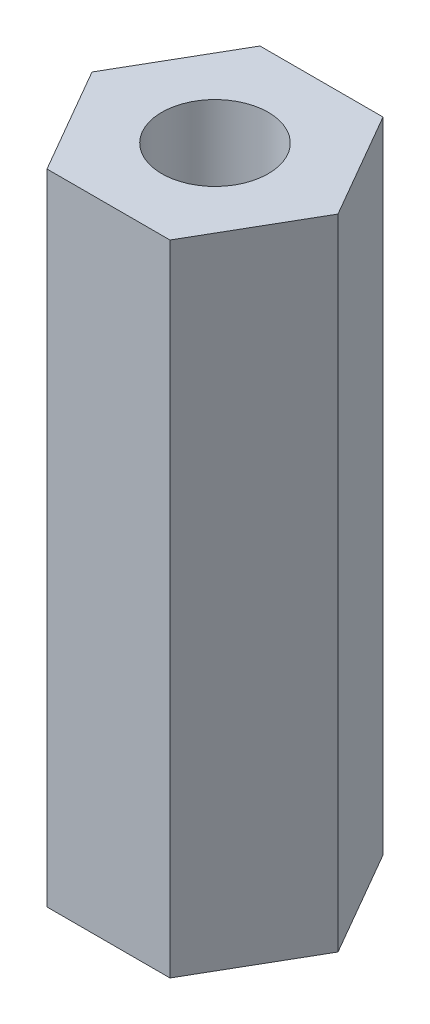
SolidWorks part; units mm, degrees
ref_plane "Front Plane" through (0, 0, 0) normal (0, 0, 1) x (1, 0, 0)
ref_plane "Top Plane" through (0, 0, 0) normal (0, 1, 0) x (1, 0, 0)
ref_plane "Right Plane" through (0, 0, 0) normal (1, 0, 0) x (0, 0, -1)
sketch "Sketch1" plane through (0, 0, 0) normal (0, 1, 0) x (1, 0, 0)
  line L0 (0, 0) -> (2.9329, 0) construction
  line L1 (2.9329, 0) -> (1.4665, 2.54)
  line L2 (1.4665, 2.54) -> (-1.4665, 2.54)
  line L3 (-1.4665, 2.54) -> (-2.9329, 0)
  line L4 (-2.9329, 0) -> (-1.4665, -2.54)
  line L5 (-1.4665, -2.54) -> (1.4665, -2.54)
  line L6 (1.4665, -2.54) -> (2.9329, 0)
  circle A0 centre (0, 0) radius 2.54 construction
  circle A1 centre (0, 0) radius 1.27
  dimension "D1" = 5.08
  dimension "D2" = 2.54
extrude "Boss-Extrude1" add sketch "Sketch1" along normal blind 15.24 contours L4 L5 L6 L1 L2 L3
